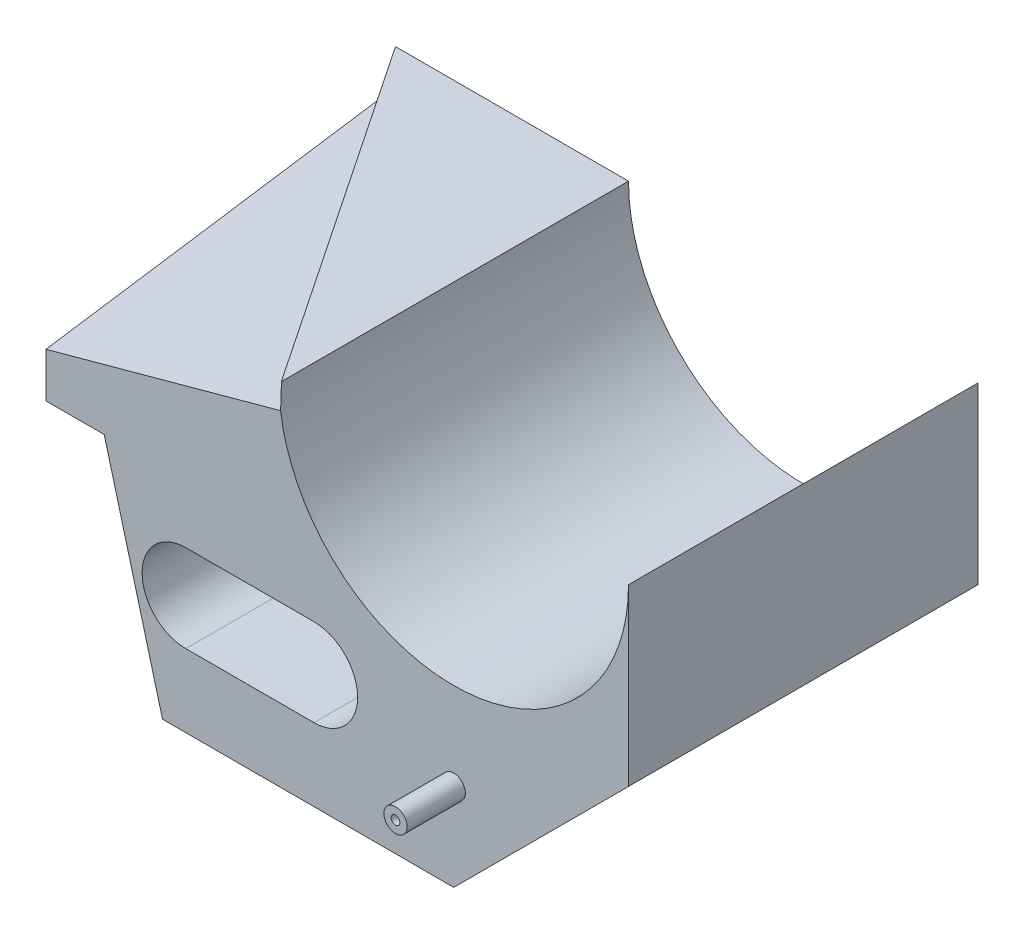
SolidWorks part; units mm, degrees
ref_plane "Front Plane" through (0, 0, 0) normal (0, 0, 1) x (1, 0, 0)
ref_plane "Top Plane" through (0, 0, 0) normal (0, 1, 0) x (1, 0, 0)
ref_plane "Right Plane" through (0, 0, 0) normal (1, 0, 0) x (0, 0, -1)
sketch "Sketch1" plane through (0, 0, 0) normal (0, 0, 1) x (1, 0, 0)
  line L0 (0, 0) -> (50, 0)
  line L1 (50, 0) -> (80, 30)
  line L2 (80, 30) -> (80, 60)
  line L3 (20, 60) -> (-20, 60)
  line L4 (-20, 60) -> (-20, 37.3205)
  line L5 (-20, 37.3205) -> (-10, 37.3205)
  line L6 (-10, 37.3205) -> (0, 0)
  arc A0 (80, 60) -> (20, 60) centre (50, 60) cw
  dimension "D4" = 30
  dimension "D1" = 50
  dimension "D2" = 135
  dimension "D3" = 80
  dimension "D5" = 105
  dimension "D6" = 20
  dimension "D7" = 60
  dimension "D8" = 10
extrude "Boss-Extrude1" add sketch "Sketch1" along normal mid plane 60
sketch "Sketch2" plane through (0, 0, 30) normal (0, 0, 1) x (1, 0, 0)
  line L0 (4, 20) -> (26, 20) construction
  line L1 (4, 27.5) -> (26, 27.5)
  line L2 (4, 12.5) -> (26, 12.5)
  arc A0 (4, 27.5) -> (4, 12.5) centre (4, 20) ccw
  arc A1 (26, 12.5) -> (26, 27.5) centre (26, 20) ccw
  point P2 (15, 20)
  dimension "D1" = 15
  dimension "D2" = 22
  dimension "D3" = 20
  dimension "D4" = 15
extrude "Cut-Extrude1" cut sketch "Sketch2" against normal offset from surface (40 mm away) 20
sketch3d "3DSketch1"
  line L0 (-20, 54, -30) -> (-20, 45, 30)
  line L1 (-20, 60, -30) -> (-20, 37.3205, -30) construction
  line L2 (-20, 60, 30) -> (-20, 37.3205, 30) construction
  line L3 (-20, 45, 30) -> (20.2667, 56.0089, 30)
  line L4 (20.2667, 56.0089, 30) -> (-20, 54, -30)
  arc A0 (80, 60, 30) -> (20, 60, 30) centre (50, 60, 30) ccw construction
  point P10 (50, 60, 0)
  dimension "D1" = 6
  dimension "D2" = 15
  dimension "D3" = 4
extrude "Cut-Extrude2" cut sketch "3DSketch1" along direction (0, -1, 0) on the side against the normal through all
sketch "Sketch3" plane through (0, 0, 30) normal (0, 0, 1) x (1, 0, 0)
  line L0 (0, 0) -> (50, 0) construction
  circle A0 centre (50, 15) radius 2
  circle A1 centre (50, 15) radius 0.75
  dimension "D1" = 1.5
  dimension "D2" = 4
  dimension "D3" = 50
  dimension "D4" = 15
extrude "Boss-Extrude2" add sketch "Sketch3" along normal blind 10
